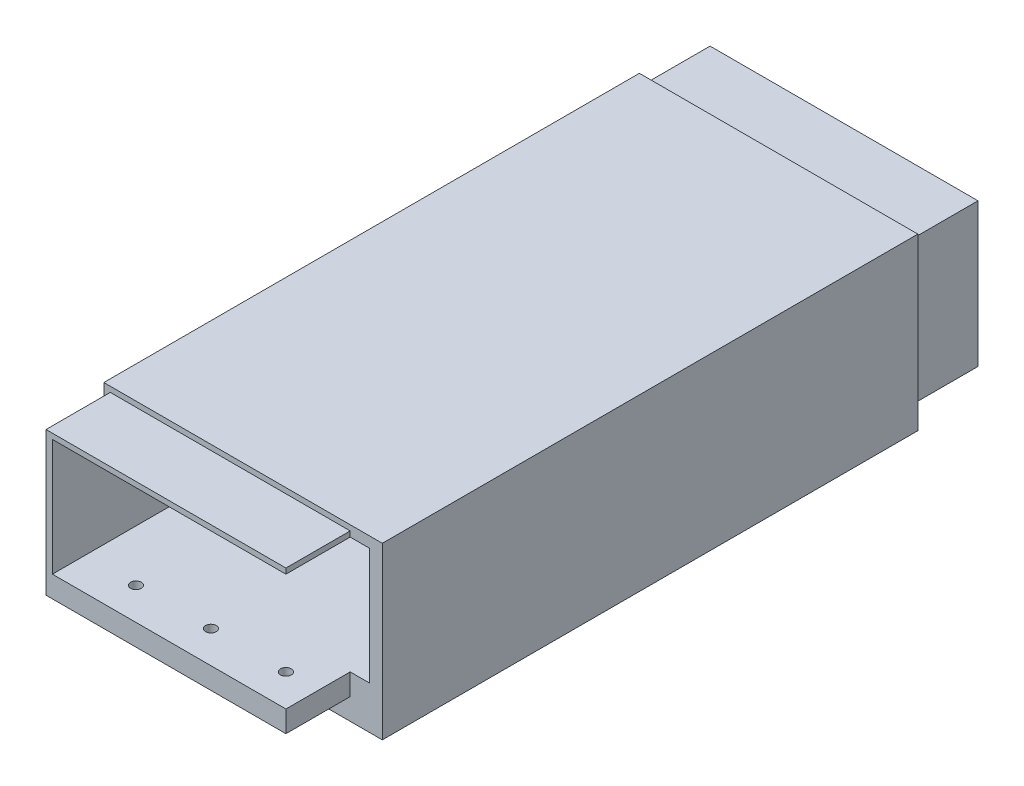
SolidWorks part; units mm, degrees
ref_plane "前视基准面" through (0, 0, 0) normal (0, 0, 1) x (1, 0, 0)
ref_plane "上视基准面" through (0, 0, 0) normal (0, 1, 0) x (1, 0, 0)
ref_plane "右视基准面" through (0, 0, 0) normal (1, 0, 0) x (0, 0, -1)
sketch "草图1" plane through (0, 0, 1390) normal (0, 0, 1) x (1, 0, 0)
  line L1 (-119.3024, 140.0174) -> (5.7729, 140.0174)
  line L2 (-119.3024, 140.0174) -> (-119.3024, 73.0247)
  line L3 (-119.3024, 73.0247) -> (5.7729, 73.0247)
  line L4 (5.7729, 140.0174) -> (5.7729, 73.0247)
  line L5 (-116.3024, 137.5174) -> (1.6976, 137.5174)
  line L6 (-116.3024, 137.5174) -> (-116.3024, 83.0247)
  line L7 (-116.3024, 83.0247) -> (1.6976, 83.0247)
  line L8 (1.6976, 137.5174) -> (1.6976, 83.0247)
extrude "凸台-拉伸1" add sketch "草图1" along normal up to surface (30 mm away)
sketch "草图2" plane through (0, 0, 1420) normal (0, 0, 1) x (1, 0, 0)
  line L1 (-122.3024, 63.0247) -> (7.6976, 63.0247)
  line L2 (-122.3024, 63.0247) -> (-122.3024, 142.5174)
  line L3 (-122.3024, 142.5174) -> (7.6976, 142.5174)
  line L4 (7.6976, 63.0247) -> (7.6976, 142.5174)
extrude "凸台-拉伸2" add sketch "草图2" along normal blind 250
sketch "草图3" plane through (0, 0, 1420) normal (0, 0, -1) x (-1, 0, 0)
  line L1 (-1.6976, 137.5174) -> (116.3024, 137.5174)
  line L2 (-1.6976, 137.5174) -> (-1.6976, 83.0247)
  line L3 (-1.6976, 83.0247) -> (116.3024, 83.0247)
  line L4 (116.3024, 137.5174) -> (116.3024, 83.0247)
extrude "切除-拉伸1" cut sketch "草图3" against normal up to next
sketch "草图4" plane through (0, 0, 1670) normal (0, 0, 1) x (1, 0, 0)
  line L0 (-122.3024, 142.5174) -> (-122.3024, 63.0247) construction
  line L1 (-119.3024, 140.0174) -> (4.6976, 140.0174)
  line L2 (-119.3024, 140.0174) -> (-119.3024, 73.0247)
  line L3 (-119.3024, 73.0247) -> (4.6976, 73.0247)
  line L4 (4.6976, 140.0174) -> (4.6976, 73.0247)
  line L5 (7.6976, 63.0247) -> (7.6976, 142.5174) construction
  line L6 (7.6976, 142.5174) -> (-122.3024, 142.5174) construction
  line L7 (-122.3024, 63.0247) -> (7.6976, 63.0247) construction
  line L9 (-116.3024, 137.5174) -> (1.6976, 137.5174)
  line L10 (-116.3024, 137.5174) -> (-116.3024, 83.0247)
  line L11 (-116.3024, 83.0247) -> (1.6976, 83.0247)
  line L12 (1.6976, 137.5174) -> (1.6976, 83.0247)
  dimension "D1" = 3
  dimension "D2" = 3
  dimension "D3" = 2.5
  dimension "D4" = 10
extrude "凸台-拉伸3" add sketch "草图4" along normal blind 30
sketch "草图5" plane through (0, 73.0247, 0) normal (0, -1, 0) x (1, 0, 0)
  circle A0 centre (-92.3024, 1405) radius 2.5
  circle A1 centre (-57.3024, 1405) radius 2.5
  circle A2 centre (-22.3024, 1405) radius 2.5
extrude "切除-拉伸2" cut sketch "草图5" against normal up to next
sketch "草图6" plane through (0, 73.0247, 0) normal (0, -1, 0) x (1, 0, 0)
  circle A0 centre (-92.3024, 1685) radius 2.5
  circle A1 centre (-57.3024, 1685) radius 2.5
  circle A2 centre (-22.3024, 1685) radius 2.5
extrude "切除-拉伸3" cut sketch "草图6" against normal up to next
sketch "草图9" plane through (7.6976, 0, 0) normal (1, 0, 0) x (0, 0, -1)
  line L0 (-1670, 142.5174) -> (-1420, 142.5174) construction
  line L1 (-1670, 142.5174) -> (-1710, 142.5174)
  line L2 (-1670, 142.5174) -> (-1670, 63.0247)
  line L3 (-1670, 63.0247) -> (-1710, 63.0247)
  line L4 (-1710, 142.5174) -> (-1710, 63.0247)
  line L5 (-1820, 63.0247) -> (-1670, 63.0247) construction
  dimension "D1" = 40
extrude "切除-拉伸6" cut sketch "草图9" against normal blind 15
